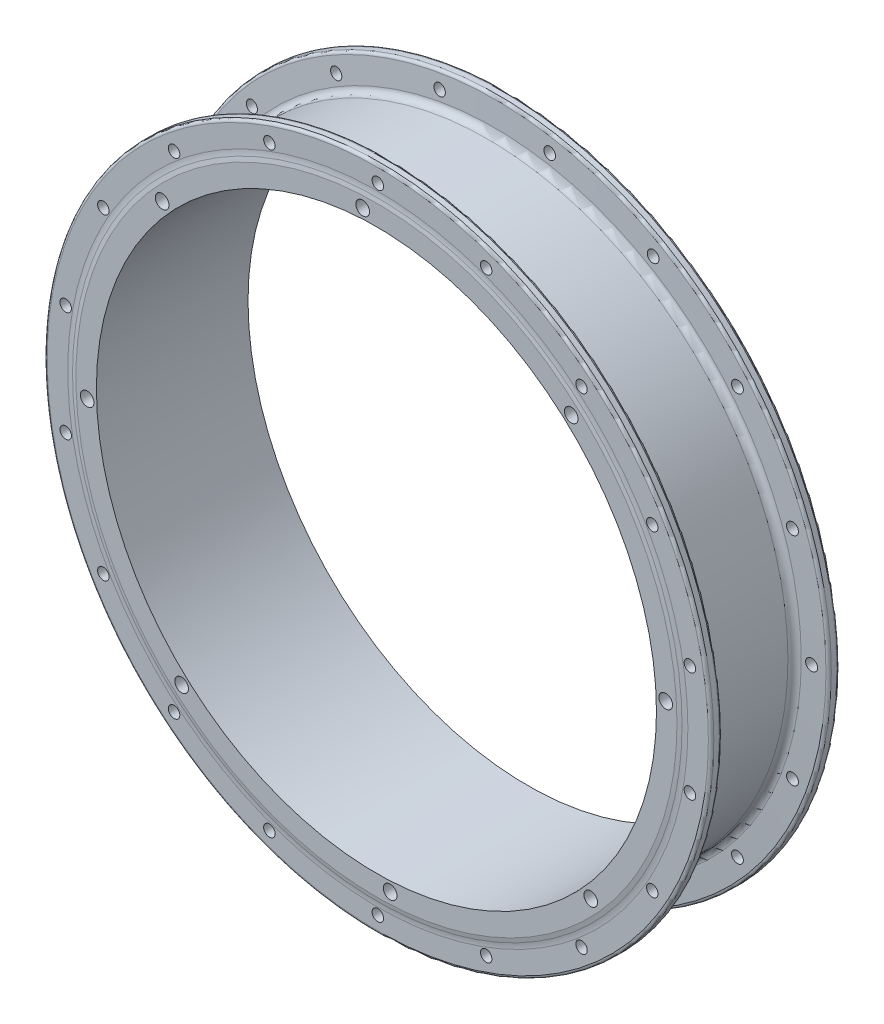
SolidWorks part; units mm, degrees
ref_plane "Спереди" through (0, 0, 0) normal (0, 0, 1) x (1, 0, 0)
ref_plane "Сверху" through (0, 0, 0) normal (0, 1, 0) x (1, 0, 0)
ref_plane "Справа" through (0, 0, 0) normal (1, 0, 0) x (0, 0, -1)
sketch "Эскиз1" plane through (0, 0, 0) normal (0, 1, 0) x (1, 0, 0)
  line L0 (0, 0) -> (0, 150) construction
  line L1 (0, 0) -> (-122, 0) construction
  line L2 (0, 24) -> (-110, 24) construction
  line L3 (0, 0) -> (-121, 0) construction
  line L4 (-110, 24) -> (-110, 6.8893)
  line L5 (-122, 1) -> (-122, 3.0008)
  line L6 (-121.0452, 3.9997) -> (-112.3869, 4.3919)
  line L7 (18.0519, 23.5) -> (-59.7289, 23.5) construction
  line L8 (-121, 47) -> (-113, 47)
  line L9 (-121.0452, 43.0003) -> (-112.3869, 42.6081)
  line L10 (-122, 46) -> (-122, 43.9992)
  line L11 (0, 47) -> (-121, 47) construction
  line L12 (-110, 24) -> (-110, 40.1107)
  line L13 (-110, 50) -> (-110, 55)
  line L14 (-110, 55) -> (0, 55)
  line L15 (-121, 0) -> (-113.5, 0)
  line L16 (-111.5508, -0.1918) -> (-110, -0.5)
  line L17 (-110, -0.5) -> (0, -0.5)
  line L18 (0, 55) -> (0, -0.5)
  arc A0 (-110, 6.8893) -> (-112.3869, 4.3919) centre (-112.5, 6.8893) cw
  arc A1 (-122, 1) -> (-121, 0) centre (-121, 1) ccw
  arc A2 (-122, 3.0008) -> (-121.0452, 3.9997) centre (-121, 3.0008) cw
  arc A3 (-122, 43.9992) -> (-121.0452, 43.0003) centre (-121, 43.9992) ccw
  arc A4 (-122, 46) -> (-121, 47) centre (-121, 46) cw
  arc A5 (-110, 40.1107) -> (-112.3869, 42.6081) centre (-112.5, 40.1107) ccw
  arc A6 (-113.5, 0) -> (-111.5508, -0.1918) centre (-113.5, -10) cw
  arc A7 (-113, 47) -> (-110, 50) centre (-113, 50) ccw
  point P10 (-110, 4.5)
  point P29 (-110, 42.5)
  point P35 (0, 0)
  point P36 (0, 0)
  point P37 (-112.3869, 0)
  point P40 (-112.516, 0)
  point P43 (-110, 47)
  dimension "D5" = 2.5
  dimension "D6" = 1
  dimension "D11" = 10
  dimension "D13" = 3
  dimension "D1" = 122
  dimension "D2" = 24
  dimension "D3" = 110
  dimension "D4" = 19.5
  dimension "D7" = 23.5
  dimension "D8" = 55
  dimension "D9" = 4
  dimension "D10" = 1
  dimension "D12" = 8.5
revolve "Повернуть1" add sketch "Эскиз1" angle 360 about L0
sketch "Эскиз2" plane through (0, 0, 0.5) normal (0, 0, 1) x (1, 0, 0)
  circle A0 centre (0, 0) radius 116 construction
  circle A1 centre (0, 116) radius 2.1
  circle A2 centre (39.6743, 109.0043) radius 2.1
  circle A3 centre (74.5634, 88.8612) radius 2.1
  circle A4 centre (100.4589, 58) radius 2.1
  circle A5 centre (114.2377, 20.1432) radius 2.1
  circle A6 centre (114.2377, -20.1432) radius 2.1
  circle A7 centre (100.4589, -58) radius 2.1
  circle A8 centre (74.5634, -88.8612) radius 2.1
  circle A9 centre (39.6743, -109.0043) radius 2.1
  circle A10 centre (0, -116) radius 2.1
  circle A11 centre (-39.6743, -109.0043) radius 2.1
  circle A12 centre (-74.5634, -88.8612) radius 2.1
  circle A13 centre (-100.4589, -58) radius 2.1
  circle A14 centre (-114.2377, -20.1432) radius 2.1
  circle A15 centre (-114.2377, 20.1432) radius 2.1
  circle A16 centre (-100.4589, 58) radius 2.1
  circle A17 centre (-74.5634, 88.8612) radius 2.1
  circle A18 centre (-39.6743, 109.0043) radius 2.1
  point P41 (0, 0)
  dimension "D1" = 232
  dimension "D2" = 4.2
  dimension "D3" = 18
extrude "Вырез-Вытянуть1" cut sketch "Эскиз2" against normal blind 10
sketch "Эскиз3" plane through (0, 0, -55) normal (0, 0, -1) x (-1, 0, 0)
  circle A0 centre (0, 0) radius 116 construction
  circle A1 centre (116, 0) radius 2.1
  circle A2 centre (109.0043, -39.6743) radius 2.1
  circle A3 centre (88.8612, -74.5634) radius 2.1
  circle A4 centre (58, -100.4589) radius 2.1
  circle A5 centre (20.1432, -114.2377) radius 2.1
  circle A6 centre (-20.1432, -114.2377) radius 2.1
  circle A7 centre (-58, -100.4589) radius 2.1
  circle A8 centre (-88.8612, -74.5634) radius 2.1
  circle A9 centre (-109.0043, -39.6743) radius 2.1
  circle A10 centre (-116, 0) radius 2.1
  circle A11 centre (-109.0043, 39.6743) radius 2.1
  circle A12 centre (-88.8612, 74.5634) radius 2.1
  circle A13 centre (-58, 100.4589) radius 2.1
  circle A14 centre (-20.1432, 114.2377) radius 2.1
  circle A15 centre (20.1432, 114.2377) radius 2.1
  circle A16 centre (58, 100.4589) radius 2.1
  circle A17 centre (88.8612, 74.5634) radius 2.1
  circle A18 centre (109.0043, 39.6743) radius 2.1
  point P42 (0, 0)
  dimension "D1" = 232
  dimension "D2" = 4.2
  dimension "D3" = 18
extrude "Вырез-Вытянуть2" cut sketch "Эскиз3" against normal blind 20
sketch "Эскиз4" plane through (0, 0, 0.5) normal (0, 0, 1) x (1, 0, 0)
  circle A0 centre (0, 0) radius 106 construction
  circle A1 centre (-5.0316, 105.8805) radius 2.5
  circle A2 centre (71.311, 78.4267) radius 2.5
  circle A3 centre (0, 0) radius 106 construction
  circle A4 centre (105.8805, 5.0316) radius 2.5
  circle A5 centre (0, 0) radius 106 construction
  circle A6 centre (78.4267, -71.311) radius 2.5
  circle A7 centre (0, 0) radius 106 construction
  circle A8 centre (5.0316, -105.8805) radius 2.5
  circle A9 centre (0, 0) radius 106 construction
  circle A10 centre (-71.311, -78.4267) radius 2.5
  circle A11 centre (0, 0) radius 106 construction
  circle A12 centre (-105.8805, -5.0316) radius 2.5
  circle A13 centre (0, 0) radius 106 construction
  circle A14 centre (-78.4267, 71.311) radius 2.5
  circle A15 centre (0, 0) radius 106 construction
  point P17 (0, 0)
  dimension "D1" = 212
  dimension "D2" = 5
  dimension "D4" = 81.1289
  dimension "D3" = 8
extrude "Вырез-Вытянуть4" cut sketch "Эскиз4" against normal blind 25
sketch "Эскиз5" plane through (0, 0, -55) normal (0, 0, -1) x (-1, 0, 0)
  circle A0 centre (0, 0) radius 106 construction
  circle A1 centre (-16.1193, 104.7672) radius 2.5
  circle A2 centre (62.6836, 85.4797) radius 2.5
  circle A3 centre (104.7672, 16.1193) radius 2.5
  circle A4 centre (85.4797, -62.6836) radius 2.5
  circle A5 centre (16.1193, -104.7672) radius 2.5
  circle A6 centre (-62.6836, -85.4797) radius 2.5
  circle A7 centre (-104.7672, -16.1193) radius 2.5
  circle A8 centre (-85.4797, 62.6836) radius 2.5
  point P22 (0, 0)
  dimension "D1" = 212
  dimension "D2" = 5
  dimension "D3" = 8
extrude "Вырез-Вытянуть5" cut sketch "Эскиз5" against normal blind 25
sketch "Эскиз6" plane through (0, 0, -55) normal (0, 0, -1) x (-1, 0, 0)
  circle A0 centre (0, 0) radius 102.5
  dimension "D1" = 205
extrude "Вырез-Вытянуть6" cut sketch "Эскиз6" against normal through all
